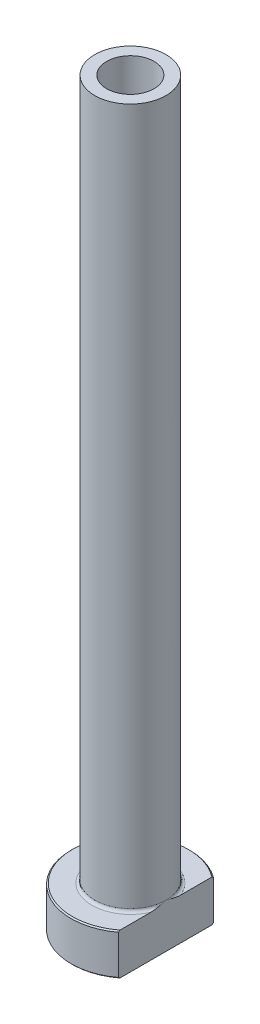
SolidWorks part; units mm, degrees
ref_plane "Front Plane" through (0, 0, 0) normal (0, 0, 1) x (1, 0, 0)
ref_plane "Top Plane" through (0, 0, 0) normal (0, 1, 0) x (1, 0, 0)
ref_plane "Right Plane" through (0, 0, 0) normal (1, 0, 0) x (0, 0, -1)
sketch "Sketch1" plane through (0, 0, 0) normal (0, 0, 1) x (1, 0, 0)
  line L0 (-4, 125) -> (-6, 125)
  line L1 (-6, 125) -> (-6, 7)
  line L2 (-6, 7) -> (-10, 7)
  line L3 (-10, 7) -> (-10, 0)
  line L4 (8.8, 0) -> (-8.8, 0) construction
  line L5 (-10, 0) -> (-4.25, 0)
  line L6 (-4, 80) -> (-4, 125)
  line L7 (0, 92.1877) -> (0, -15.5353) construction
  line L8 (0, -11) -> (0, 11) construction
  line L9 (-4, 80) -> (-4.25, 68)
  line L10 (-4.25, 68) -> (-4.25, 0)
  dimension "D1" = 0.25
  dimension "ID" = 8
  dimension "OD" = 12
  dimension "L" = 125
  dimension "H" = 20
  dimension "T" = 7
  dimension "N" = 45
  dimension "D2" = 12
  dimension "L-N" = 80
revolve "Revolve1" add sketch "Sketch1" angle 360 about L7
fillet "Fillet1" radius 0.5 1 edges at (0, 7, 6)
chamfer "Chamfer1" distance 0.2 angle 45 2 edges at (0, 7, 10) (0, 0, 10)
sketch "Sketch2" plane through (0, 0, 0) normal (0, -1, 0) x (1, 0, 0)
  line L0 (6, 8) -> (6, -8)
  circle A0 centre (0, 0) radius 10 construction
  arc A1 (6, 8) -> (6, -8) centre (0, 0) cw
  circle A2 centre (0, 0) radius 6 construction
extrude "Cut-Extrude1" cut sketch "Sketch2" against normal through all
chamfer "Chamfer2" distance 0.5 angle 45 1 edges at (0, 0, 4.25)
